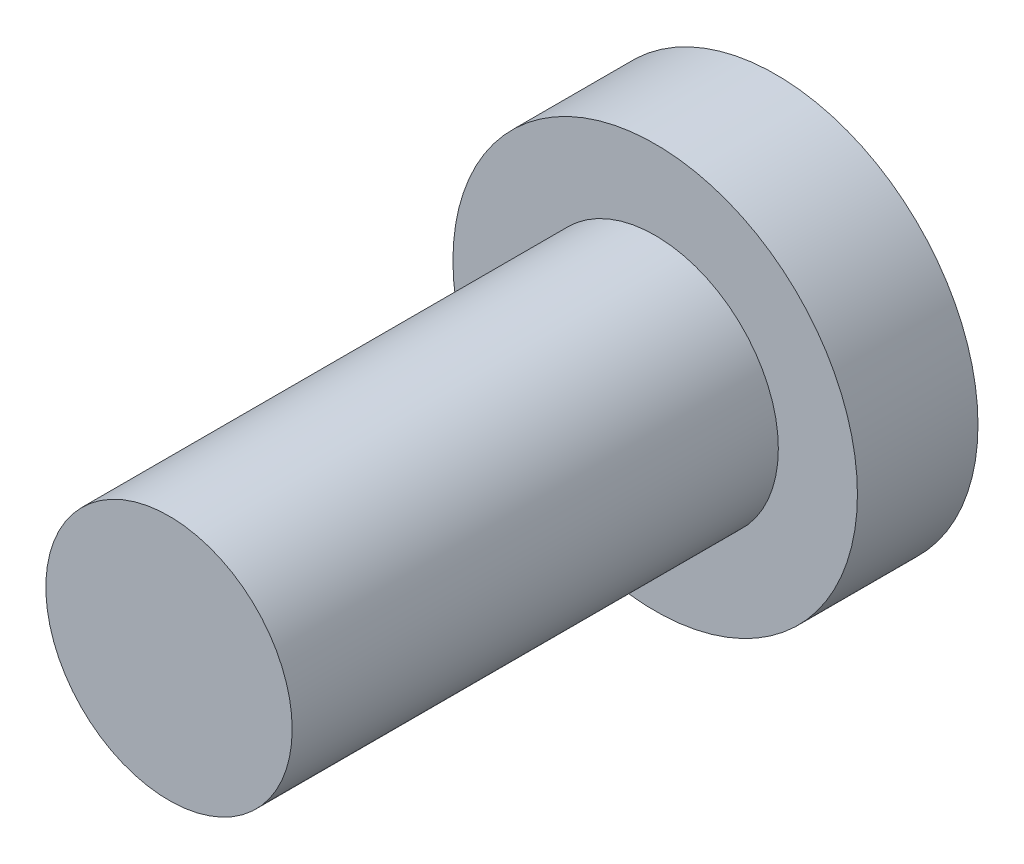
SolidWorks part; units mm, degrees
ref_plane "Front Plane" through (0, 0, 0) normal (0, 0, 1) x (1, 0, 0)
ref_plane "Top Plane" through (0, 0, 0) normal (0, 1, 0) x (1, 0, 0)
ref_plane "Right Plane" through (0, 0, 0) normal (1, 0, 0) x (0, 0, -1)
sketch "Sketch6" plane through (0, 0, 0) normal (1, 0, 0) x (0, 0, -1)
  line L0 (-9.525, 0) -> (22.525, 0) construction
  line L1 (4.3586, 0) -> (-4.3586, 0) construction
  line L2 (-9.525, 0) -> (-9.525, -2.413)
  line L3 (-9.525, -2.413) -> (0, -2.413)
  line L4 (0, 4.3586) -> (0, -4.3586) construction
  line L5 (0, -2.413) -> (0, -3.9624)
  line L6 (0, -3.9624) -> (2.3622, -3.9624)
  line L7 (2.3622, -3.9624) -> (2.3622, 0)
  line L8 (2.3622, 0) -> (-9.525, 0)
  dimension "L" = 9.525
  dimension "H" = 2.3622
  dimension "A" = 7.9248
  dimension "D" = 4.826
revolve "Revolve1" add sketch "Sketch6" angle 360 about L0
sketch "Sketch7" plane through (0, 0, -2.3622) normal (0, 0, -1) x (-1, 0, 0)
  line L2 (-1.1811, 0.6819) -> (-1.1811, -0.6819)
  line L4 (-1.1811, -0.6819) -> (0, -1.3638)
  line L5 (0, -1.3638) -> (1.1811, -0.6819)
  line L6 (1.1811, -0.6819) -> (1.1811, 0.6819)
  line L7 (1.1811, 0.6819) -> (0, 1.3638)
  line L8 (0, 1.3638) -> (-1.1811, 0.6819)
  circle A0 centre (0, 0) radius 1.1811 construction
  dimension "J" = 2.3622
extrude "HEX" cut sketch "Sketch7" against normal blind 2.032
